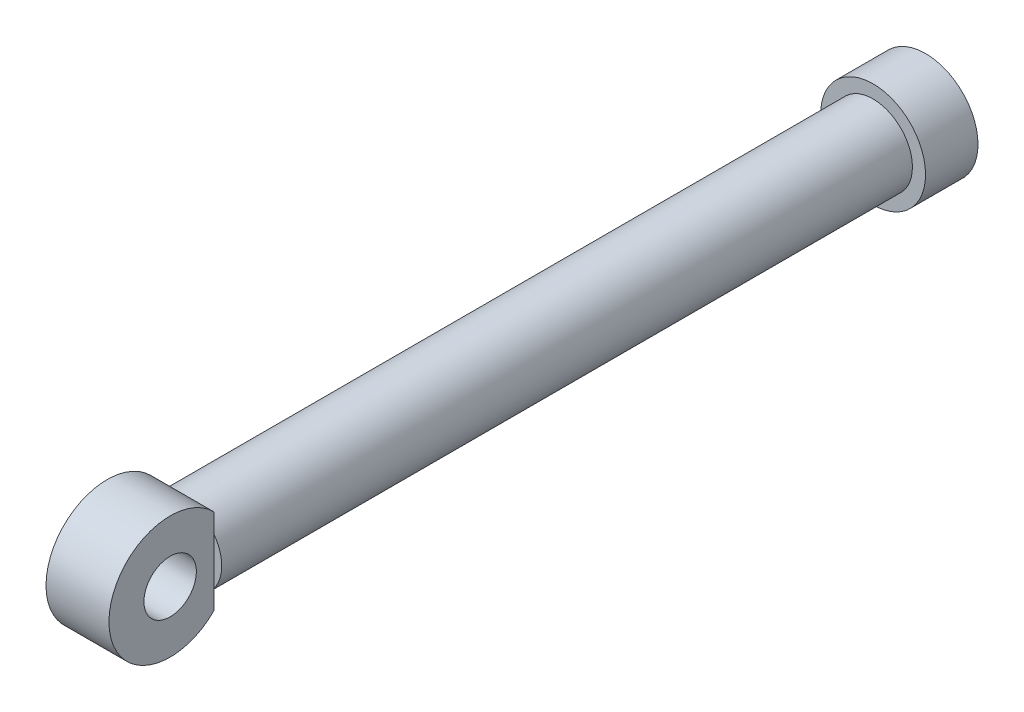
SolidWorks part; units mm, degrees
ref_plane "前视基准面" through (0, 0, 0) normal (0, 0, 1) x (1, 0, 0)
ref_plane "上视基准面" through (0, 0, 0) normal (0, 1, 0) x (1, 0, 0)
ref_plane "右视基准面" through (0, 0, 0) normal (1, 0, 0) x (0, 0, -1)
sketch "草图1" plane through (0, 0, 0) normal (0, 0, 1) x (1, 0, 0)
  circle A0 centre (0, 0) radius 30
  dimension "D1" = 60
extrude "拉伸1" add sketch "草图1" along normal blind 30
sketch "草图2" plane through (0, 0, 30) normal (0, 0, 1) x (1, 0, 0)
  circle A0 centre (0, 0) radius 22.5
  dimension "D1" = 45
extrude "拉伸2" add sketch "草图2" along normal blind 395
sketch "草图3" plane through (0, 0, 0) normal (1, 0, 0) x (0, 0, -1)
  line L0 (-199.1647, 0) -> (-479.2373, 0) construction
  line L1 (-425, 22.5) -> (-425, -22.5) construction
  line L2 (-425, 24.4949) -> (-425, -24.4949)
  arc A0 (-425, 24.4949) -> (-425, -24.4949) centre (-450, 0) ccw
  circle A1 centre (-450, 0) radius 15
  dimension "D1" = 70
  dimension "D3" = 30
  dimension "D2" = 25
extrude "拉伸3" add sketch "草图3" along normal mid plane 36
